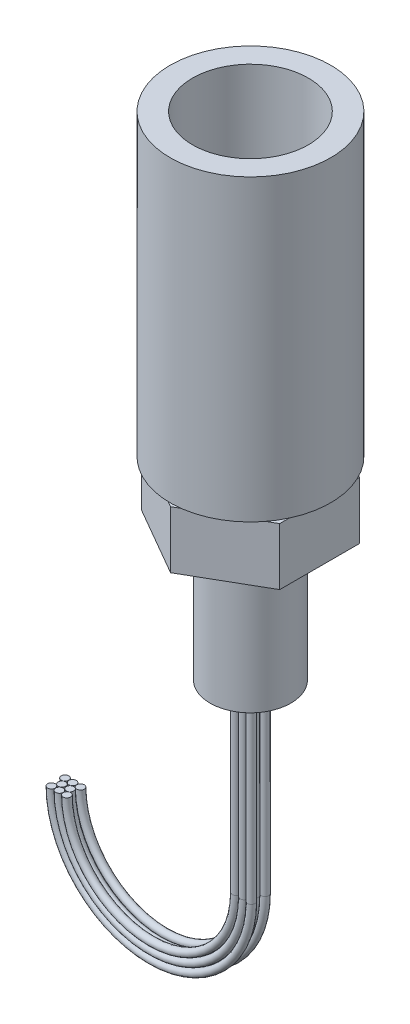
SolidWorks part; units mm, degrees
ref_plane "Front" through (0, 0, 0) normal (0, 0, 1) x (1, 0, 0)
ref_plane "Top" through (0, 0, 0) normal (0, 1, 0) x (1, 0, 0)
ref_plane "Right" through (0, 0, 0) normal (1, 0, 0) x (0, 0, -1)
sketch "Sketch1" plane through (0, 0, 0) normal (0, 1, 0) x (1, 0, 0)
  line L1 (0, 10.9985) -> (-9.525, 5.4993)
  line L2 (-9.525, 5.4993) -> (-9.525, -5.4993)
  line L3 (-9.525, -5.4993) -> (0, -10.9985)
  line L4 (0, -10.9985) -> (9.525, -5.4993)
  line L5 (9.525, -5.4993) -> (9.525, 5.4993)
  line L6 (9.525, 5.4993) -> (0, 10.9985)
  circle A0 centre (0, 0) radius 9.525 construction
  dimension "D1" = 19.05
extrude "Extrude1" add sketch "Sketch1" along normal blind 7.874
sketch "Sketch2" plane through (0, 0, 0) normal (0, 0, 1) x (1, 0, 0)
  line L0 (0, 0) -> (0, -1.8388) construction
  line L1 (8.8011, 7.874) -> (8.8011, 11.6586)
  line L2 (0, 7.874) -> (9.525, 7.874) construction
  line L3 (8.8011, 11.6586) -> (9.398, 11.6586)
  line L4 (9.398, 11.6586) -> (9.398, 13.2334)
  line L5 (9.398, 13.2334) -> (8.8011, 13.2334)
  line L6 (8.8011, 13.2334) -> (8.8011, 14.8844)
  line L7 (8.8011, 14.8844) -> (9.398, 14.8844)
  line L8 (9.398, 14.8844) -> (9.398, 16.4592)
  line L9 (9.398, 16.4592) -> (8.8011, 16.4592)
  line L10 (8.8011, 16.4592) -> (8.8011, 17.272)
  line L11 (8.8011, 17.272) -> (0, 17.272)
  line L12 (0, 17.272) -> (0, 7.874)
  line L13 (-9.398, 11.6586) -> (-9.398, 13.2334) construction
  line L14 (-8.8011, 7.874) -> (-8.8011, 11.6586) construction
  line L15 (8.8011, 7.874) -> (0, 7.874)
  dimension "D1" = 17.6022
  dimension "D2" = 18.796
  dimension "D3" = 1.5748
  dimension "D4" = 1.651
  dimension "D5" = 0.8128
  dimension "D6" = 9.398
revolve "Revolve1" add sketch "Sketch2" angle 360 about L0
sketch "Sketch3" plane through (0, 17.272, 0) normal (0, 1, 0) x (-1, 0, 0)
  circle A0 centre (0, 0) radius 7.875
  dimension "D1" = 15.75
extrude "Extrude2" add sketch "Sketch3" along normal blind 10.41
sketch "Sketch4" plane through (0, 27.682, 0) normal (0, 1, 0) x (-1, 0, 0)
  circle A0 centre (0, -5.08) radius 0.955
  circle A1 centre (0, 0) radius 5.08 construction
  dimension "D1" = 1.91
  dimension "D2" = 10.16
extrude "Extrude8" cut sketch "Sketch4" against normal up to surface (10.41 mm away)
pattern_circular "CirPattern1" count 8 over 360 about axis through (0, 0, 0) along (0, 1, 0) of "Extrude8"
sketch "1" plane through (0.0995, 27.682, 4.4802) normal (0, 1, 0) x (-1, 0, 0)
  circle A0 centre (0.0995, -2.5702) radius 0.955
  dimension "D1" = 1.91
  dimension "D2" = 1.91
extrude "Extrude9" cut sketch "1" against normal up to surface (10.41 mm away)
sketch "Sketch8" plane through (0, 0, 0) normal (0, -1, 0) x (1, 0, 0)
  circle A0 centre (0, 0) radius 5.5562
  dimension "D1" = 11.1125
extrude "Extrude7" add sketch "Sketch8" along normal blind 18.2803
sketch "Sketch9" plane through (0, 0, 0) normal (0, 0, 1) x (1, 0, 0)
  line L0 (0, 0) -> (0, -1.4263) construction
  circle A0 centre (7.1, 0.2843) radius 0.89
  circle A1 centre (-7.1, 0.2843) radius 0.89 construction
  dimension "D1" = 1.78
  dimension "D2" = 12.42
revolve "o-ring 12.42x1.78" add sketch "Sketch9" angle 360 about L0
sketch "Sketch10" plane through (0, 0, 0) normal (0, 0, 1) x (1, 0, 0)
  line L0 (9.0805, 8.3623) -> (9.0805, 11.4357)
  line L1 (9.0805, 11.4357) -> (9.594, 11.4357)
  line L2 (9.594, 11.4357) -> (9.594, 13.0867)
  line L3 (9.594, 13.0867) -> (9.0805, 13.0867)
  line L4 (9.0805, 13.0867) -> (9.0805, 14.6107)
  line L5 (9.0805, 14.6107) -> (9.594, 14.6107)
  line L6 (9.594, 14.6107) -> (9.594, 18.0108)
  line L7 (9.594, 18.0108) -> (7.9756, 18.0108)
  line L8 (7.9756, 18.0108) -> (7.9756, 49.5103)
  line L9 (7.9756, 49.5103) -> (11.049, 49.5103)
  line L10 (11.049, 49.5103) -> (11.049, 8.3623)
  line L11 (11.049, 8.3623) -> (9.0805, 8.3623)
  line L12 (0, 0) -> (0, -19.5879) construction
  line L13 (0, -4.7979) -> (0, 8.6873) construction
  line L14 (0, -18.2803) -> (0, 0) construction
  dimension "D1" = 18.161
  dimension "D2" = 15.9512
  dimension "D3" = 22.098
  dimension "D4" = 41.148
  dimension "D5" = 3.0734
  dimension "D6" = 1.651
  dimension "D7" = 1.524
revolve "Locking sleeve" add sketch "Sketch10" angle 360 about L12
sketch "Sketch11" plane through (0, -18.2803, 0) normal (0, -1, 0) x (1, 0, 0)
  circle A0 centre (0, 0.9087) radius 0.5207
  circle A1 centre (0.5588, 0) radius 0.5207
  circle A2 centre (0, -0.9087) radius 0.5207
  circle A3 centre (-0.5588, 0) radius 0.5207
  circle A4 centre (1.0668, 0.9381) radius 0.5207
  circle A5 centre (-1.0664, 0.9383) radius 0.5207
  circle A6 centre (-1.0668, -0.9381) radius 0.5207
  circle A7 centre (1.0664, -0.9383) radius 0.5207
  dimension "D1" = 1.0414
  dimension "D2" = 0.5588
  dimension "D3" = 1.0668
  dimension "D4" = 1.0668
  dimension "D5" = 1.0668
  dimension "D6" = 1.0668
  dimension "D7" = 1.0668
  dimension "D8" = 1.0668
  dimension "D9" = 1.0668
  dimension "D10" = 1.0668
  dimension "D11" = 1.0668
  dimension "D12" = 1.0668
  dimension "D13" = 1.0668
  dimension "D14" = 0.5588
extrude "Extrude10" add sketch "Sketch11" along normal blind 25.4
sketch "Sketch12" plane through (0, -43.6803, 0) normal (0, -1, 0) x (1, 0, 0)
  line L0 (-12.7, 9.8009) -> (-12.7, -10.6166) construction
  circle A0 centre (1.0664, -0.9383) radius 0.5207 construction
  circle A1 centre (0.5588, 0) radius 0.5207
  circle A2 centre (0.5588, 0) radius 0.5207
  circle A3 centre (0, -0.9087) radius 0.5207 construction
  circle A4 centre (-1.0668, -0.9381) radius 0.5207 construction
  circle A5 centre (-0.5588, 0) radius 0.5207 construction
  circle A6 centre (-1.0664, 0.9383) radius 0.5207 construction
  circle A7 centre (0, 0.9087) radius 0.5207 construction
  circle A8 centre (1.0668, 0.9381) radius 0.5207 construction
  circle A9 centre (1.0664, -0.9383) radius 0.5207
  circle A10 centre (0, -0.9087) radius 0.5207
  circle A11 centre (-1.0668, -0.9381) radius 0.5207
  circle A12 centre (-0.5588, 0) radius 0.5207
  circle A13 centre (-1.0664, 0.9383) radius 0.5207
  circle A14 centre (0, 0.9087) radius 0.5207
  circle A15 centre (1.0668, 0.9381) radius 0.5207
  dimension "D2" = 12.7
  dimension "D1" = 0
revolve "Revolve2" add sketch "Sketch12" angle 180 about L0
